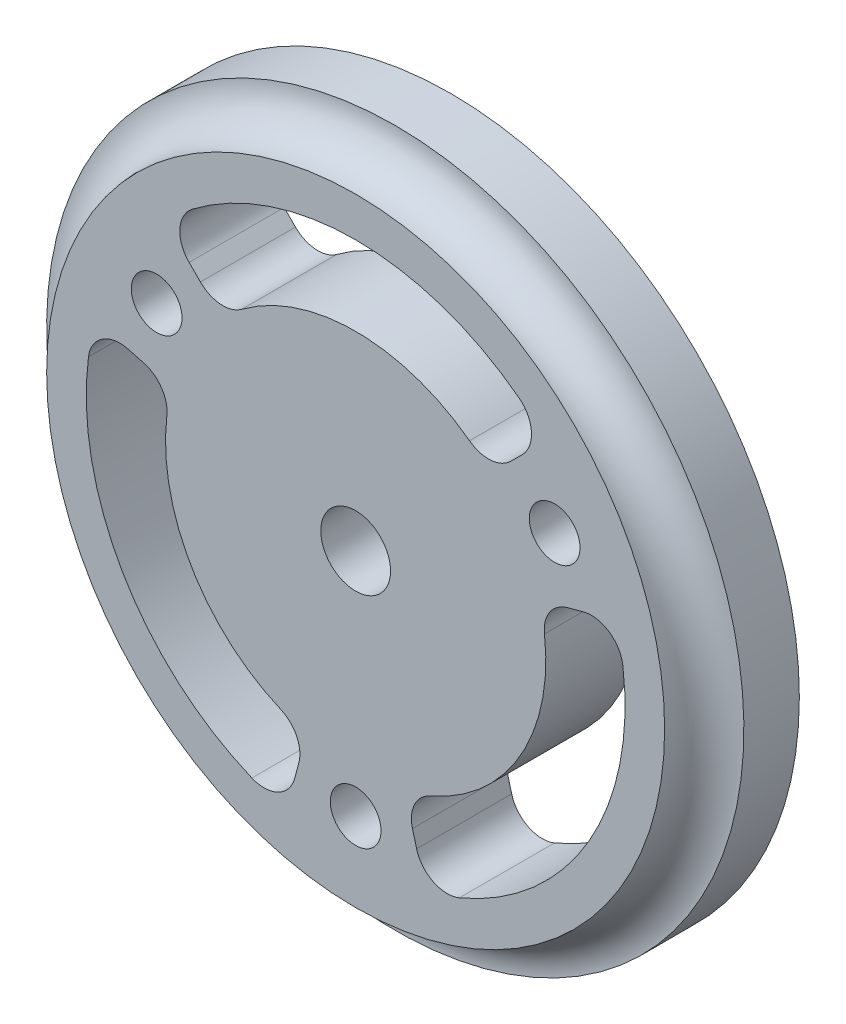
SolidWorks part; units mm, degrees
ref_plane "Face" through (0, 0, 0) normal (0, 0, 1) x (1, 0, 0)
ref_plane "Dessus" through (0, 0, 0) normal (0, 1, 0) x (1, 0, 0)
ref_plane "Droite" through (0, 0, 0) normal (1, 0, 0) x (0, 0, -1)
sketch "Esquisse1" plane through (0, 0, 0) normal (0, 0, 1) x (1, 0, 0)
  line L0 (0, -36.9559) -> (0, 56.4063) construction
  line L1 (28.4463, 0) -> (-48.8693, 0) construction
  line L2 (0, 0) -> (23.6546, 13.657) construction
  line L3 (0, 0) -> (18.3653, 18.3653) construction
  line L4 (9.798, 9.798) -> (10.5119, 10.5119)
  line L5 (-9.798, 9.798) -> (-10.5119, 10.5119)
  line L6 (13.3843, 3.5863) -> (14.3595, 3.8476)
  line L7 (3.5863, -13.3843) -> (3.8476, -14.3595)
  line L8 (-3.5863, -13.3843) -> (-3.8476, -14.3595)
  line L9 (-13.3843, 3.5863) -> (-14.3595, 3.8476)
  circle A0 centre (0, 0) radius 22
  circle A1 centre (0, 0) radius 12 construction
  circle A2 centre (0, 0) radius 2.2
  circle A3 centre (0, 0) radius 17 construction
  circle A4 centre (0, -14.5) radius 1.6
  circle A5 centre (-12.5574, 7.25) radius 1.6
  circle A6 centre (0, 0) radius 18.5 construction
  circle A7 centre (0, 0) radius 14.5 construction
  circle A8 centre (12.5574, 7.25) radius 1.6
  arc A9 (10.3107, 13.5163) -> (10.5119, 10.5119) centre (9.0977, 11.9261) cw
  arc A10 (7.1861, 9.6104) -> (9.798, 9.798) centre (8.3837, 11.2122) ccw
  arc A11 (7.1861, 9.6104) -> (-7.1861, 9.6104) centre (0, 0) ccw
  arc A12 (10.3107, 13.5163) -> (-10.3107, 13.5163) centre (0, 0) ccw
  arc A13 (-7.1861, 9.6104) -> (-9.798, 9.798) centre (-8.3837, 11.2122) cw
  arc A14 (-10.3107, 13.5163) -> (-10.5119, 10.5119) centre (-9.0977, 11.9261) ccw
  arc A15 (16.8608, 2.1712) -> (14.3595, 3.8476) centre (14.8772, 1.9158) ccw
  arc A16 (11.9159, 1.4181) -> (13.3843, 3.5863) centre (13.9019, 1.6545) cw
  arc A17 (4.7298, -11.0285) -> (11.9159, 1.4181) centre (0, 0) ccw
  arc A18 (6.5501, -15.6875) -> (16.8608, 2.1712) centre (0, 0) ccw
  arc A19 (6.5501, -15.6875) -> (3.8476, -14.3595) centre (5.7795, -13.8419) cw
  arc A20 (4.7298, -11.0285) -> (3.5863, -13.3843) centre (5.5182, -12.8666) ccw
  arc A21 (-6.5501, -15.6875) -> (-3.8476, -14.3595) centre (-5.7795, -13.8419) ccw
  arc A22 (-4.7298, -11.0285) -> (-3.5863, -13.3843) centre (-5.5182, -12.8666) cw
  arc A23 (-11.9159, 1.4181) -> (-4.7298, -11.0285) centre (0, 0) ccw
  arc A24 (-16.8608, 2.1712) -> (-6.5501, -15.6875) centre (0, 0) ccw
  arc A25 (-16.8608, 2.1712) -> (-14.3595, 3.8476) centre (-14.8772, 1.9158) cw
  arc A26 (-11.9159, 1.4181) -> (-13.3843, 3.5863) centre (-13.9019, 1.6545) ccw
  point P22 (12.0208, 12.0208)
  point P28 (8.4853, 8.4853)
  point P31 (-8.4853, 8.4853)
  point P34 (-12.0208, 12.0208)
  dimension "D1" = 120
  dimension "D2" = 45
  dimension "D3" = 2
extrude "Extrusion1" add sketch "Esquisse1" along normal blind 6
sketch "Esquisse2" plane through (0, 0, 0) normal (1, 0, 0) x (0, 0, -1)
  line L0 (18.9227, 0) -> (-25.4902, 0) construction
  line L1 (-18.217, 22) -> (11.4432, 22) construction
  line L2 (0, 22.7739) -> (0, 8.7949) construction
  line L3 (0, -22) -> (0, 22) construction
  line L4 (-3.5, 22) -> (-6, 22)
  line L5 (-6, 23.6739) -> (-6, -21.1001) construction
  line L6 (-6, 22) -> (-6, 19.5)
  arc A0 (-6, 19.5) -> (-3.5, 22) centre (-6, 22) ccw
  dimension "D1" = 22
revolve "Enlèvement de matière-Révolution1" cut sketch "Esquisse2" angle 360 about L0
